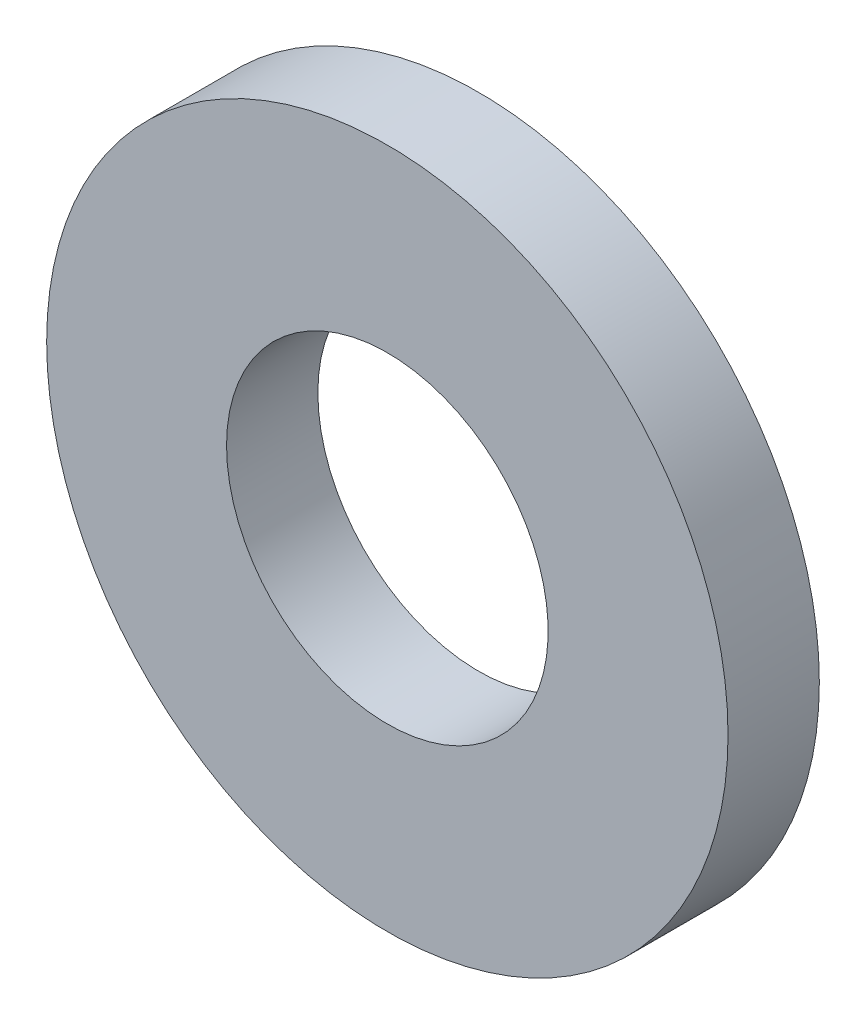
SolidWorks part; units mm, degrees
ref_plane "Front Plane" through (0, 0, 0) normal (0, 0, 1) x (1, 0, 0)
ref_plane "Top Plane" through (0, 0, 0) normal (0, 1, 0) x (1, 0, 0)
ref_plane "Right Plane" through (0, 0, 0) normal (1, 0, 0) x (0, 0, -1)
ref_plane "Plane1" through (0, 0, 0) normal (0, 0, -1) x (-1, 0, 0)
sketch "Sketch1" plane through (0, 0, 0) normal (0, 0, -1) x (-1, 0, 0)
  line L0 (-3.6662, 0) -> (-1.8331, 3.175) construction
  line L1 (-1.8331, 3.175) -> (1.8331, 3.175) construction
  line L2 (1.8331, 3.175) -> (3.6662, 0) construction
  line L3 (3.6662, 0) -> (1.8331, -3.175) construction
  line L4 (1.8331, -3.175) -> (-1.8331, -3.175) construction
  line L5 (-1.8331, -3.175) -> (-3.6662, 0) construction
  circle A0 centre (0, 0) radius 3.175
  dimension "D1" = 6.35
extrude "Extrude1" add sketch "Sketch1" along normal blind 0.8509
hole_wizard "#31 (0.12) Diameter Hole1" positions "Sketch4" profile "Sketch3" hole size "#31" standard "Ansi Inch"
sketch "Sketch4" plane through (0, 0, -0.8509) normal (0, 0, -1) x (-1, 0, 0)
  point P0 (0, 0)
sketch "Sketch3" plane through (0, 0, -0.8509) normal (1, 0, 0) x (0, 1, 0)
  line L0 (0, 0) -> (0, 0.8509)
  line L1 (0, 0.8509) -> (1.4986, 0.8509)
  line L2 (1.4986, 0.8509) -> (1.4986, 0)
  line L5 (1.4986, 0) -> (0, 0)
  line L11 (0, -6.35) -> (0, 107.95) construction
  dimension "Thru Hole Dia." = 2.9972
  dimension "Thru Hole Depth" = 0.8509
